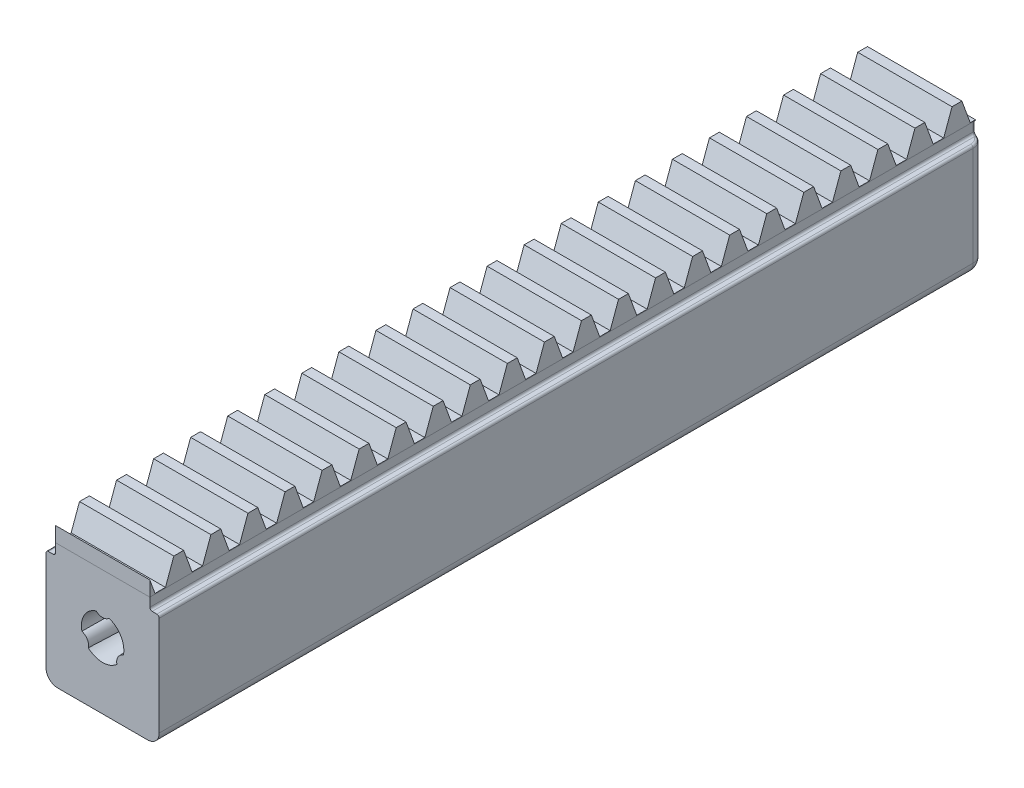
SolidWorks part; units mm, degrees
other "<ISO - Rack-spur - rectangular 1M 20PA 8FW 1PH 70L---SAll>-<TeethCuts>"
ref_plane "Front Plane" through (0, 0, 0) normal (0, 0, 1) x (1, 0, 0)
ref_plane "Top Plane" through (0, 0, 0) normal (0, 1, 0) x (1, 0, 0)
ref_plane "Right Plane" through (0, 0, 0) normal (1, 0, 0) x (0, 0, -1)
sketch "Sketch1" plane through (0, 0, 0) normal (0, 0, 1) x (1, 0, 0)
  line L1 (-4.8, -27.6214) -> (-4.8, -19.6214)
  line L2 (4.8, -27.6214) -> (4.8, -19.6214)
  line L5 (18.6624, -7.7302) -> (21.434, -8.8783)
  line L6 (14.2836, -14.2836) -> (16.4049, -16.4049)
  line L10 (-14.2836, -14.2836) -> (-16.4049, -16.4049)
  line L11 (-18.6624, -7.7302) -> (-21.434, -8.8783)
  arc A0 (4.8, -19.6214) -> (-4.8, -19.6214) centre (0, 0) ccw
  arc A1 (-21.434, -8.8783) -> (-16.4049, -16.4049) centre (0, 0) ccw
  arc A2 (16.4049, -16.4049) -> (21.434, -8.8783) centre (0, 0) ccw
  arc A3 (-4.8, -27.6214) -> (4.8, -27.6214) centre (0, -27.6214) ccw
  point P3 (0, -20.2)
  point P7 (0, -20.2)
  point P39 (0, 0)
  dimension "D1" = 40.4
  dimension "D2" = 46.4
  dimension "D5" = 9.6
  dimension "D3" = 9.6
  dimension "D4" = 8
extrude "Boss-Extrude1" add sketch "Sketch1" along normal blind 3 contours L6 A2 L5 A0 | A0 | L11 A1 L10 A0
sketch "Sketch2" plane through (0, 0, 0) normal (0, 0, -1) x (-1, 0, 0)
  line L0 (0, 0) -> (0, -10) construction
  line L2 (-4, -10) -> (-4, -6)
  line L3 (-4, -6) -> (4, -6)
  line L4 (4, -10) -> (4, -6)
  arc A0 (-4, -10) -> (4, -10) centre (0, -10) ccw
  dimension "D1" = 8
  dimension "D2" = 8
  dimension "D3" = 4
  dimension "D4" = 10
extrude "Boss-Extrude3" add sketch "Sketch2" along normal blind 70
sketch "Sketch4" plane through (0, -6, 0) normal (0, 1, 0) x (1, 0, 0)
  line L0 (4, 70) -> (4, 0) construction
  line L1 (-4, 70) -> (4, 70)
  line L2 (-4, 70) -> (-4, 0)
  line L3 (-4, 0) -> (4, 0)
  line L4 (4, 70) -> (4, 0)
extrude "Cut-Extrude2" cut sketch "Sketch4" against normal blind 3
inserted part "ISO - Rack-spur - rectangular 1M 20PA 8FW 1PH 70L---SAll"
move or copy body "Body-Move/Copy3" placed by mates yes parameters "D1"=0, "D2"=0, "D3"=0
sketch "Sketch8" plane through (0, 0, 0) normal (0, 0, -1) x (-1, 0, 0)
  line L1 (4, -10) -> (-4, -10)
  line L2 (4, -10) -> (4, -17)
  line L3 (4, -17) -> (-4, -17)
  line L4 (-4, -10) -> (-4, -17)
  dimension "D1" = 8
  dimension "D2" = 7
extrude "Boss-Extrude6" add sketch "Sketch8" along normal blind 30 contours L4 L3 L2 M4
draft "Draft8" type of draft neutral plane draft angle 50 faces to draft 1 parameters "D1"=50
sketch "Sketch9" plane through (0, 0, 3) normal (0, 0, 1) x (1, 0, 0)
  line L3 (1.5365, -22.6214) -> (1.5365, -27.6214)
  line L4 (-1.6635, -27.6214) -> (-1.6635, -22.6214)
  line L13 (-1.6635, -27.6214) -> (-3.2635, -27.6214)
  line L14 (-1.6635, -22.6214) -> (-3.2635, -22.6214)
  line L15 (-3.2635, -27.6214) -> (-3.2635, -22.6214)
  line L16 (1.5365, -27.6214) -> (3.1365, -27.6214)
  line L17 (1.5365, -22.6214) -> (3.1365, -22.6214)
  line L18 (3.1365, -27.6214) -> (3.1365, -22.6214)
  line L19 (-4.8, -19.6214) -> (4.8, -19.6214) construction
  line L20 (0, -19.6214) -> (0, -22.6214) construction
  line L21 (4.8, -22.6214) -> (-4.8, -22.6214)
  line L22 (-4.8, -27.6214) -> (-4.8, -19.6214) construction
  point P20 (0, -22.6214)
  dimension "D1" = 3
extrude "Cut-Extrude3" cut sketch "Sketch9" against normal blind 30 contours L15 L13 L4 L14 | L16 L18 L17 L3
sketch "Sketch10" plane through (0, 0, 0) normal (0, 0, 1) x (1, 0, 0)
  line L0 (0, 36.8023) -> (0, -49.1935) construction
  line L1 (-5, -9.7472) -> (5, -9.7472) construction
  line L2 (4, -9) -> (-4, -9) construction
  line L3 (5, -9.7472) -> (5, -19.7778) construction
  line L4 (5, -19.7778) -> (-5, -19.7778) construction
  line L5 (-5, -9.7472) -> (-5, -19.7778) construction
  line L6 (4.8, -9.9472) -> (4.8, -19.5778)
  line L7 (4.8, -19.5778) -> (-4.8, -19.5778)
  line L8 (-4.8, -9.9472) -> (-4.8, -19.5778)
  line L9 (-4.8, -9.9472) -> (4.8, -9.9472)
  line L10 (4, -8.9472) -> (-4, -8.9472) construction
  point P10 (0, -19.7778)
  point P11 (0, -9)
  dimension "D1" = 20.4
  dimension "D2" = 5
  dimension "D3" = 0.2
  dimension "D4" = 1
extrude "Boss-Extrude7" add sketch "Sketch10" against normal up to surface (70 mm away)
fillet "Fillet1" radius 1 5 edges at (-4.8, -14.7625, -70) (0, -19.5778, -70) (4.8, -14.7625, -70) (-4.8, -19.5778, -35) (4.8, -19.5778, -35)
fillet "Fillet3" radius 0.2 8 edges at (4, -9.4736, -69.9798) (-4, -9.4736, -69.9798) (4.5746, -9.9472, -69.6325) (-4.5746, -9.9472, -69.6325) (4.8, -9.9472, -34.5) (4, -9.9472, -34.9899) (-4.8, -9.9472, -34.5) (-4, -9.9472, -34.9899)
sketch "Sketch12" plane through (0, 0, 3) normal (0, 0, 1) x (1, 0, 0)
  line L6 (14.2836, -14.2836) -> (16.4049, -16.4049)
  line L7 (21.434, -8.8783) -> (18.6624, -7.7302)
  line L8 (-18.6624, -7.7302) -> (-21.434, -8.8783)
  line L9 (-16.4049, -16.4049) -> (-14.2836, -14.2836)
  line L10 (-4.8, -19.6214) -> (-4.8, -27.6214)
  line L11 (4.8, -27.6214) -> (4.8, -19.6214)
  line L12 (14.2836, -14.2836) -> (16.4049, -16.4049)
  line L13 (21.434, -8.8783) -> (18.6624, -7.7302)
  line L14 (-18.6624, -7.7302) -> (-21.434, -8.8783)
  line L15 (-16.4049, -16.4049) -> (-14.2836, -14.2836)
  line L16 (-4.8, -19.6214) -> (-4.8, -27.6214)
  line L17 (4.8, -27.6214) -> (4.8, -19.6214)
  arc A6 (16.4049, -16.4049) -> (21.434, -8.8783) centre (0, 0) ccw
  arc A7 (18.6624, -7.7302) -> (-18.6624, -7.7302) centre (0, 0) ccw
  arc A8 (-21.434, -8.8783) -> (-16.4049, -16.4049) centre (0, 0) ccw
  arc A9 (-14.2836, -14.2836) -> (-4.8, -19.6214) centre (0, 0) ccw
  arc A10 (-4.8, -27.6214) -> (4.8, -27.6214) centre (0, -27.6214) ccw
  arc A11 (4.8, -19.6214) -> (14.2836, -14.2836) centre (0, 0) ccw
  arc A12 (16.4049, -16.4049) -> (21.434, -8.8783) centre (0, 0) ccw
  arc A13 (18.6624, -7.7302) -> (-18.6624, -7.7302) centre (0, 0) ccw
  arc A14 (-21.434, -8.8783) -> (-16.4049, -16.4049) centre (0, 0) ccw
  arc A15 (-14.2836, -14.2836) -> (-4.8, -19.6214) centre (0, 0) ccw
  arc A16 (-4.8, -27.6214) -> (4.8, -27.6214) centre (0, -27.6214) ccw
  arc A17 (4.8, -19.6214) -> (14.2836, -14.2836) centre (0, 0) ccw
  dimension "D1" = 0
extrude "Cut-Extrude4" cut sketch "Sketch12" against normal blind 3
sketch "Sketch13" plane through (0, 0, 0) normal (0, 0, 1) x (1, 0, 0)
  line L0 (0, 20.2582) -> (0, -46.0508) construction
  circle A0 centre (0, -14) radius 1.6
  circle A1 centre (0, -11.7) radius 1
  circle A2 centre (0, -14) radius 1.3
  circle A3 centre (1.9919, -15.15) radius 1
  circle A4 centre (-1.9919, -15.15) radius 1
  dimension "D1" = 3.2
  dimension "D2" = 2.6
  dimension "D3" = 2
  dimension "D5" = 14
  dimension "D4" = 3
extrude "Cut-Extrude5" cut sketch "Sketch13" against normal blind 20 contours L0 A2 | A2 L0 | A4 A2 A1 A0 | A3 A0 A1 A2 | L0 A2 A4 A0 | A2 L0 A0 A3
chamfer "Chamfer1" distance 0.2 distance2 3 6 edges at (-1.1258, -14.65, 0) (0, -15.6, 0) (1.1258, -14.65, 0) (1.3856, -13.2, 0) (0, -12.7, 0) (-1.3856, -13.2, 0)
